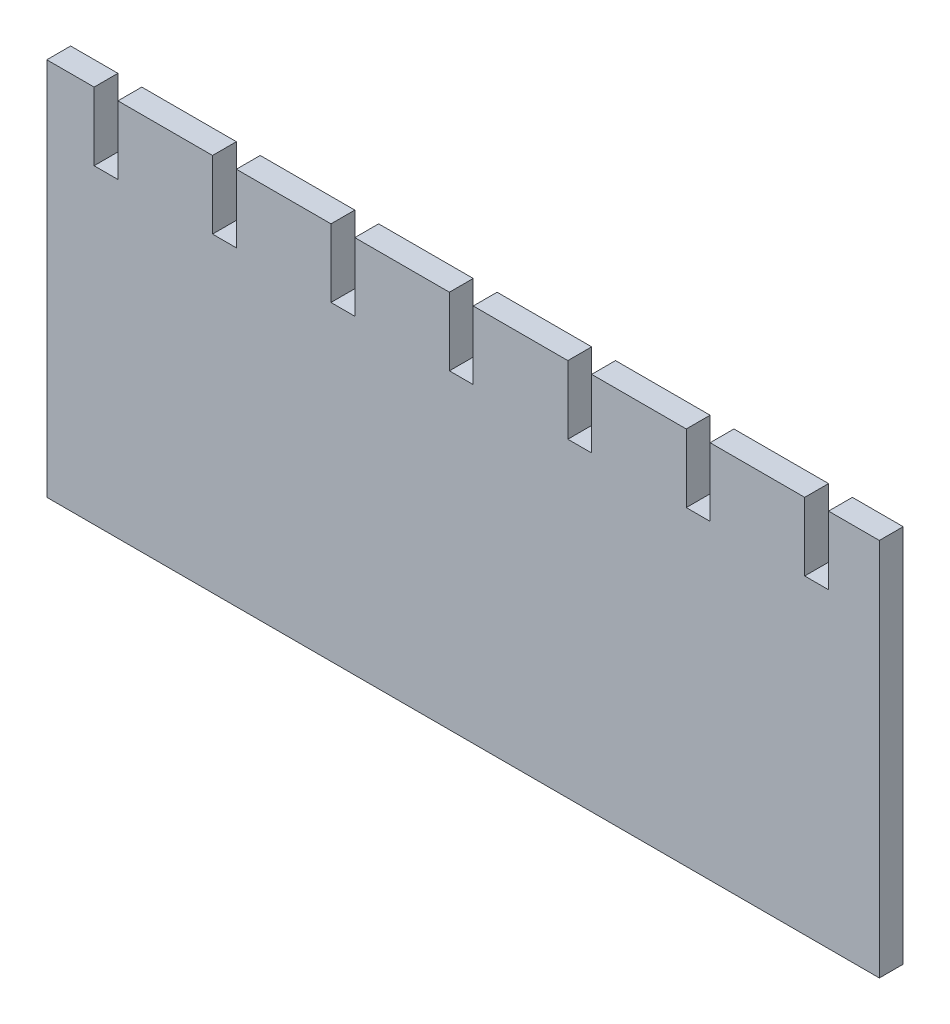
SolidWorks part; units mm, degrees
ref_plane "Front Plane" through (0, 0, 0) normal (0, 0, 1) x (1, 0, 0)
ref_plane "Top Plane" through (0, 0, 0) normal (0, 1, 0) x (1, 0, 0)
ref_plane "Right Plane" through (0, 0, 0) normal (1, 0, 0) x (0, 0, -1)
sketch "Sketch1" plane through (0, 0, 0) normal (0, 0, 1) x (1, 0, 0)
  line L0 (-53.5999, 165.2921) -> (9.9001, 165.2921)
  line L1 (298.518, -89.0806) -> (298.518, 345.3847) construction
  line L2 (298.518, -89.0806) -> (298.518, 165.2921)
  line L3 (264.4061, 165.2921) -> (298.518, 165.2921)
  line L4 (-260.3519, -89.0806) -> (-260.3519, 165.2921)
  line L7 (-228.6019, 165.2921) -> (-228.6019, 119.5664)
  line L8 (-228.6019, 119.5664) -> (-212.5999, 119.5664)
  line L9 (-212.5999, 119.5664) -> (-212.5999, 165.2921)
  line L10 (-149.0999, 165.2921) -> (-149.0999, 119.5721)
  line L11 (-133.0999, 119.5721) -> (-133.0999, 165.2921)
  line L12 (-149.0999, 119.5721) -> (-133.0999, 119.5721)
  line L13 (-69.5999, 165.2921) -> (-69.5999, 119.5721)
  line L14 (-53.5999, 119.5721) -> (-53.5999, 165.2921)
  line L15 (-69.5999, 119.5721) -> (-53.5999, 119.5721)
  line L16 (9.9001, 165.2921) -> (9.9001, 119.5721)
  line L17 (25.9001, 119.5721) -> (25.9001, 165.2921)
  line L18 (9.9001, 119.5721) -> (25.9001, 119.5721)
  line L19 (89.4001, 165.2921) -> (89.4001, 119.5721)
  line L20 (168.9021, 119.5721) -> (184.9041, 119.5721)
  line L21 (89.4001, 119.5721) -> (105.4021, 119.5721)
  line L22 (105.4021, 165.2921) -> (105.4021, 119.5721)
  line L23 (184.9041, 165.2921) -> (248.4041, 165.2921)
  line L24 (248.4041, 119.5721) -> (264.4061, 119.5721)
  line L25 (168.9021, 165.2921) -> (168.9021, 119.5721)
  line L26 (184.9041, 119.5721) -> (184.9041, 165.2921)
  line L27 (264.4061, 119.5721) -> (264.4061, 165.2921)
  line L28 (248.4041, 165.2921) -> (248.4041, 119.5721)
  line L34 (-149.0999, 165.2921) -> (-212.5999, 165.2921)
  line L35 (-228.6019, 165.2921) -> (-260.3519, 165.2921)
  line L36 (-133.0999, 165.2921) -> (-69.5999, 165.2921)
  line L37 (25.9001, 165.2921) -> (89.4001, 165.2921)
  line L38 (168.9021, 165.2921) -> (105.4021, 165.2921)
  line L43 (-260.3519, -89.0806) -> (298.518, -89.0806)
  point P0 (0, 0)
extrude "Boss-Extrude1" add sketch "Sketch1" along normal blind 16.002
equation "\"material depth\"=0.63"
equation "\"D1@Sketch1\"=\"material depth\"*34.9250"
equation "\"D3@Sketch1\"=1.25"
equation "\"D4@Sketch1\"=\"material depth\"*2.8575"
equation "\"D5@Sketch1\"=\"material depth\""
equation "\"D1@Boss-Extrude1\"=\"material depth\""
equation "\"D9@Sketch1\"=\"material depth\""
